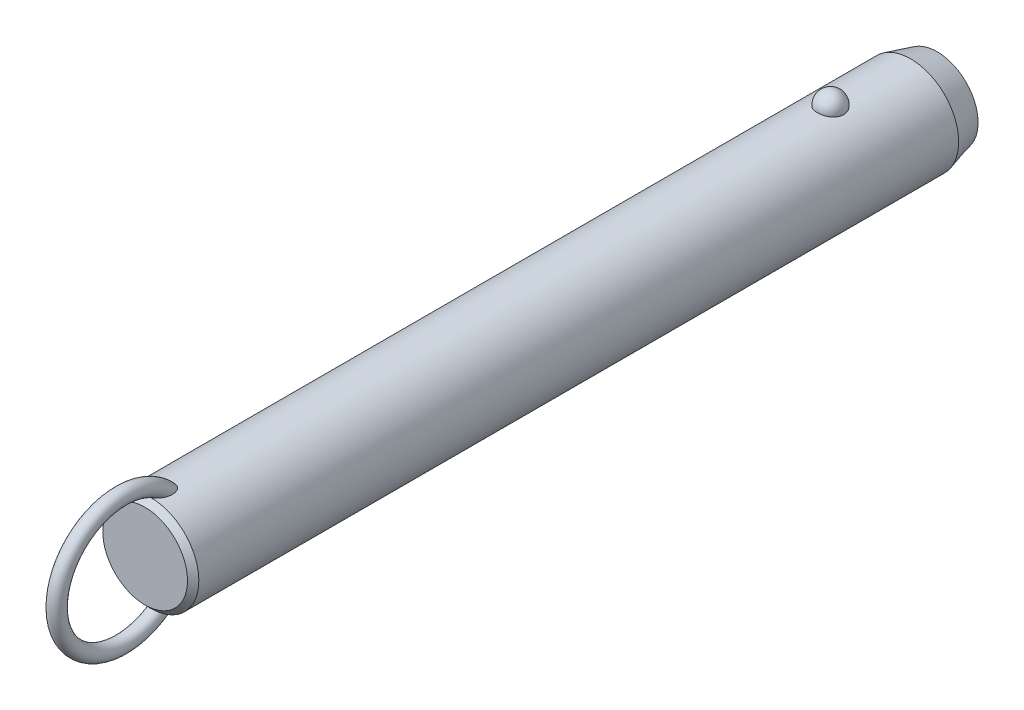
SolidWorks part; units mm, degrees
ref_plane "Front Plane" through (0, 0, 0) normal (0, 0, 1) x (1, 0, 0)
ref_plane "Top Plane" through (0, 0, 0) normal (0, 1, 0) x (1, 0, 0)
ref_plane "Right Plane" through (0, 0, 0) normal (1, 0, 0) x (0, 0, -1)
sketch "Sketch2" plane through (0, 0, 0) normal (0, 0, 1) x (1, 0, 0)
  circle A0 centre (0, 0) radius 12.7
  point P3 (0, 12.7)
  dimension "D1" = 25.4
extrude "Boss-Extrude1" add sketch "Sketch2" along normal blind 165.1
sketch "Sketch3" plane through (0, 0, 0) normal (0, 0, -1) x (-1, 0, 0)
  circle A0 centre (0, 0) radius 12.7
  dimension "D1" = 25.4
extrude "Boss-Extrude2" add sketch "Sketch3" along normal blind 31.7
chamfer "Chamfer1" distance 7 angle 15 1 edges at (-12.7, 0, -31.7)
sketch "Sketch12" plane through (0, 0, 0) normal (1, 0, 0) x (0, 0, -1)
  line L0 (-165.1, 12.7) -> (-165.1, -12.7) construction
  point P0 (-165.1, 0)
sketch "Sketch13" plane through (0, 0, 0) normal (1, 0, 0) x (0, 0, -1)
  circle A0 centre (-184.15, 0) radius 19.05
  point P2 (-165.1, 0)
  dimension "D1" = 38.1
sketch "Sketch14" plane through (0, 0, 0) normal (0, 1, 0) x (1, 0, 0)
  circle A0 centre (0, -167.1) radius 2
  point P2 (0, -165.1)
  dimension "D1" = 4
sweep "Sweep1" add profiles "Sketch14" path "Sketch13"
sketch "Sketch15" plane through (0, 0, 165.1) normal (0, 0, 1) x (1, 0, 0)
  circle A0 centre (0, 0) radius 12.7
  dimension "D1" = 25.4
extrude "Boss-Extrude3" add sketch "Sketch15" along normal blind 12.7
chamfer "Chamfer2" distance 1.5 angle 45 1 edges at (12.7, 0, 177.8)
sketch "Sketch18" plane through (0, 0, 0) normal (1, 0, 0) x (0, 0, -1)
  line L0 (24.7, 12.7) -> (-169.951, 12.7) construction
  line L1 (3.5, 16.2) -> (3.5, 9.2)
  line L2 (-169.951, -12.7) -> (24.7, -12.7) construction
  arc A0 (3.5, 16.2) -> (3.5, 9.2) centre (3.5, 12.7) ccw
  point P4 (0, 12.7)
  dimension "D1" = 28.9
revolve "Revolve1" add sketch "Sketch18" angle 360 about L1
